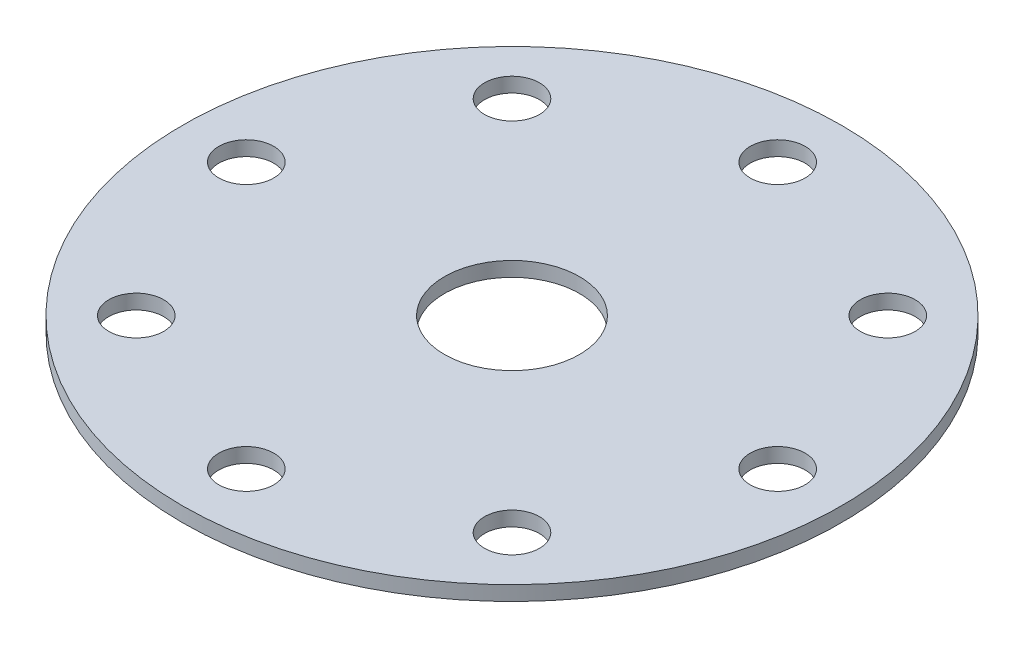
SolidWorks part; units mm, degrees
ref_plane "Front Plane" through (0, 0, 0) normal (0, 0, 1) x (1, 0, 0)
ref_plane "Top Plane" through (0, 0, 0) normal (0, 1, 0) x (1, 0, 0)
ref_plane "Right Plane" through (0, 0, 0) normal (1, 0, 0) x (0, 0, -1)
sketch "Sketch1" plane through (0, 0, 0) normal (0, 1, 0) x (1, 0, 0)
  circle A0 centre (0, 0) radius 57.15
extrude "Boss-Extrude1" add sketch "Sketch1" along normal blind 2.54
hole_wizard "1-12 Tapped Hole1" positions "Sketch7" profile "Sketch8" tap size "1-12" standard "ANSI Inch"
sketch "Sketch7" plane through (0, 2.54, 0) normal (0, 1, 0) x (1, 0, 0)
  point P0 (0, 0)
sketch "Sketch8" plane through (0, 2.54, 0) normal (1, 0, 0) x (0, 0, 1)
  line L0 (0, 0) -> (0, 2.54)
  line L1 (0, 2.54) -> (11.7081, 2.54)
  line L2 (11.7081, 2.54) -> (11.7081, 0)
  line L5 (11.7081, 0) -> (0, 0)
  line L11 (0, -6.35) -> (0, 107.95) construction
  dimension "Thru Tap Drill Dia." = 23.4163
  dimension "Thru Tap Drill Depth" = 2.54
hole_wizard "3/8 (0.375) Diameter Hole1" positions "Sketch9" profile "Sketch10" hole size "3/8" standard "ANSI Inch"
sketch "Sketch9" plane through (0, 2.54, 0) normal (0, 1, 0) x (1, 0, 0)
  circle A0 centre (0, 0) radius 46.0756
  arc A1 (0, 46.0756) -> (32.5804, 32.5804) centre (0, 0) cw
  arc A2 (0, 46.0756) -> (-32.5804, 32.5804) centre (0, 0) ccw
  arc A3 (0, -46.0756) -> (32.5804, -32.5804) centre (0, 0) ccw
  arc A4 (0, -46.0756) -> (-32.5804, -32.5804) centre (0, 0) cw
  point P4 (0, 46.0756)
  point P5 (32.5804, 32.5804)
  point P8 (-32.5804, 32.5804)
  point P10 (0, -46.0756)
  point P11 (32.5804, -32.5804)
  point P13 (-32.5804, -32.5804)
  point P19 (46.0756, 0)
  point P27 (-46.0756, 0)
sketch "Sketch10" plane through (-46.0756, 2.54, 0) normal (1, 0, 0) x (0, 0, 1)
  line L0 (0, 0) -> (0, 2.54)
  line L1 (0, 2.54) -> (4.7625, 2.54)
  line L2 (4.7625, 2.54) -> (4.7625, 0)
  line L5 (4.7625, 0) -> (0, 0)
  line L11 (0, -6.35) -> (0, 107.95) construction
  dimension "Thru Hole Dia." = 9.525
  dimension "Thru Hole Depth" = 2.54
